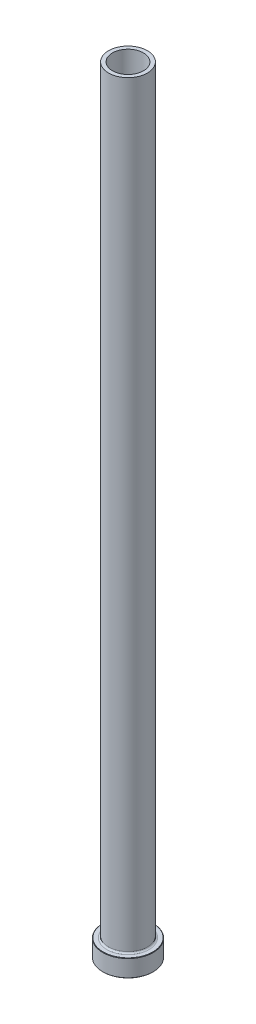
SolidWorks part; units mm, degrees
ref_plane "Front Plane" through (0, 0, 0) normal (0, 0, 1) x (1, 0, 0)
ref_plane "Top Plane" through (0, 0, 0) normal (0, 1, 0) x (1, 0, 0)
ref_plane "Right Plane" through (0, 0, 0) normal (1, 0, 0) x (0, 0, -1)
sketch "Sketch1" plane through (0, 0, 0) normal (0, 0, 1) x (1, 0, 0)
  line L0 (-8, 400) -> (-10, 400)
  line L1 (-10, 400) -> (-10, 9)
  line L2 (-10, 9) -> (-13, 9)
  line L3 (-13, 9) -> (-13, 0)
  line L4 (14.3, 0) -> (-14.3, 0) construction
  line L5 (-13, 0) -> (-8.25, 0)
  line L6 (-8, 345) -> (-8, 400)
  line L7 (0, 92.1877) -> (0, -15.5353) construction
  line L8 (0, -14.3) -> (0, 14.3) construction
  line L9 (-8, 345) -> (-8.25, 333)
  line L10 (-8.25, 333) -> (-8.25, 0)
  dimension "D1" = 0.25
  dimension "ID" = 16
  dimension "OD" = 20
  dimension "L" = 400
  dimension "H" = 26
  dimension "T" = 9
  dimension "N" = 55
  dimension "D2" = 12
revolve "Revolve1" add sketch "Sketch1" angle 360 about L7
fillet "Fillet1" radius 0.8 1 edges at (0, 9, 10)
chamfer "Chamfer1" distance 0.2 angle 45 2 edges at (0, 9, 13) (0, 0, 13)
chamfer "Chamfer3" distance 0.5 angle 45 1 edges at (0, 0, 8.25)
